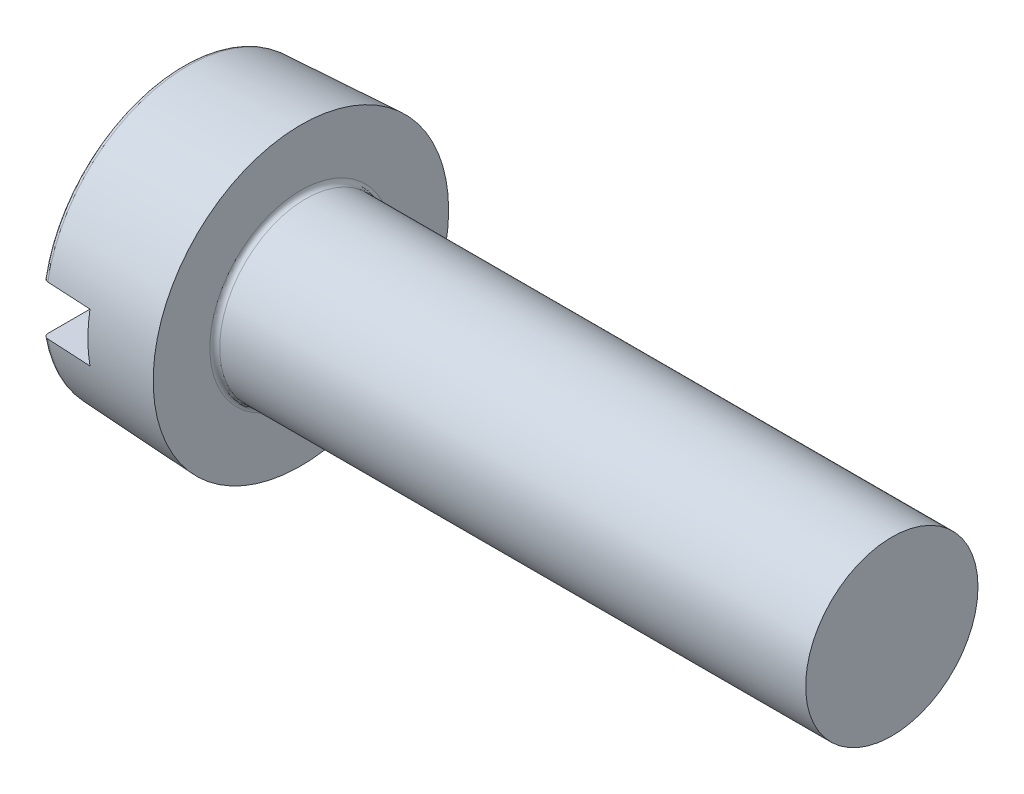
SolidWorks part; units mm, degrees
ref_plane "Front" through (0, 0, 0) normal (0, 0, 1) x (1, 0, 0)
ref_plane "Top" through (0, 0, 0) normal (0, 1, 0) x (1, 0, 0)
ref_plane "Right" through (0, 0, 0) normal (1, 0, 0) x (0, 0, -1)
ref_plane "Plane1" through (2.4, 0, 0) normal (1, 0, 0) x (0, 0, -1)
sketch "Sketch2" plane through (2.4, 0, 0) normal (1, 0, 0) x (0, 0, -1)
  circle A0 centre (0, 0) radius 3
  dimension "dk" = 6
extrude "BaseHead" add sketch "Sketch2" against normal blind 2.4 draft 3
sketch "Sketch3" plane through (2.4, -1.1101, -1.3544) normal (1, 0, 0) x (0, 0, -1)
  line L0 (-1.3544, 1.1101) -> (-0.1544, 1.1101) construction
  circle A0 centre (-1.3544, 1.1101) radius 1.75
  circle A1 centre (-1.3544, 1.1101) radius 3 construction
  dimension "d" = 3.5
  dimension "a" = 1.2
extrude "BaseBody" add sketch "Sketch3" along normal blind 12
sketch "Sketch4" plane through (-1.9, -1.9, 0) normal (0, 0, 1) x (0, 1, 0)
  line L1 (1.4, -1.9) -> (2.4, -1.9)
  line L2 (1.4, -1.9) -> (1.4, -2.9)
  line L3 (1.4, -2.9) -> (2.4, -2.9)
  line L4 (2.4, -1.9) -> (2.4, -2.9)
  line L5 (4.7742, -1.9) -> (-0.9742, -1.9) construction
  dimension "n" = 1
  dimension "m" = 0.5
  dimension "t" = 1
extrude "Slot" cut sketch "Sketch4" against normal through all and the other way through all
fillet "HeadFillet" radius 0.1 3 edges at (2.4, 0, -1.75) (0, -2.8742, 0) (0, 2.8742, 0)
sketch "Sketch1" plane through (0, 0, 0) normal (0, 0, 1) x (1, 0, 0)
  line L0 (5.5483, 0) -> (-2.9147, 0) construction
  line L1 (2.4, 6.555) -> (-23.6, 6.555)
  line L2 (2.4, 6.555) -> (2.4, 1.555)
  line L3 (2.4, 1.555) -> (-25.1, 1.555)
  line L8 (-23.6, 1.75) -> (-25.1, 1.555)
  line L9 (-23.6, 6.555) -> (-23.6, 1.75)
  line L10 (2.4, -3) -> (2.4, 3) construction
  line L11 (14.4, -1.75) -> (14.4, 1.75) construction
  line L12 (14.4, 1.75) -> (2.5, 1.75) construction
  dimension "b1" = 3.11
  dimension "b" = 38
  dimension "x" = 1.5
  dimension "dd" = 5
sketch "Sketch5" plane through (0, 0, 0) normal (0, 0, 1) x (1, 0, 0)
  line L0 (14.5625, 1.75) -> (14.5625, 2.075)
  line L1 (14.5625, 2.075) -> (14.2375, 2.075)
  line L2 (14.2375, 2.075) -> (14.2375, 1.75)
  line L3 (14.2375, 1.75) -> (14.4, 1.4685)
  line L4 (14.4, 1.4685) -> (14.5625, 1.75)
  line L5 (14.4, -1.75) -> (14.4, 1.75) construction
  line L6 (0, 0) -> (15.9087, 0) construction
  dimension "D1" = 3.5
  dimension "D2" = 0.325
revolve "Cut-Revolve10" [suppressed] cut sketch "Sketch5" angle 360 about L6
pattern_linear "LPattern10" [suppressed] count 28 spacing 0.39 along (1, 0, 0)
equation "\"m@Sketch4\" = \"n@Sketch4\" / 2"
equation "\"D1@Plane1\"=\"k@BaseHead\""
equation "\"D1@Sketch5\" = \"d@Sketch3\""
equation "\"D2@Sketch5\" =  ( \"d@Sketch3\" - \"D2@ThreadCosmetic1\" )  / 2"
equation "\"D3@LPattern10\" = \"D2@Sketch5\" * 1.2"
equation "\"D1@LPattern10\" = \"D1@ThreadCosmetic1\" / \"D3@LPattern10\""
